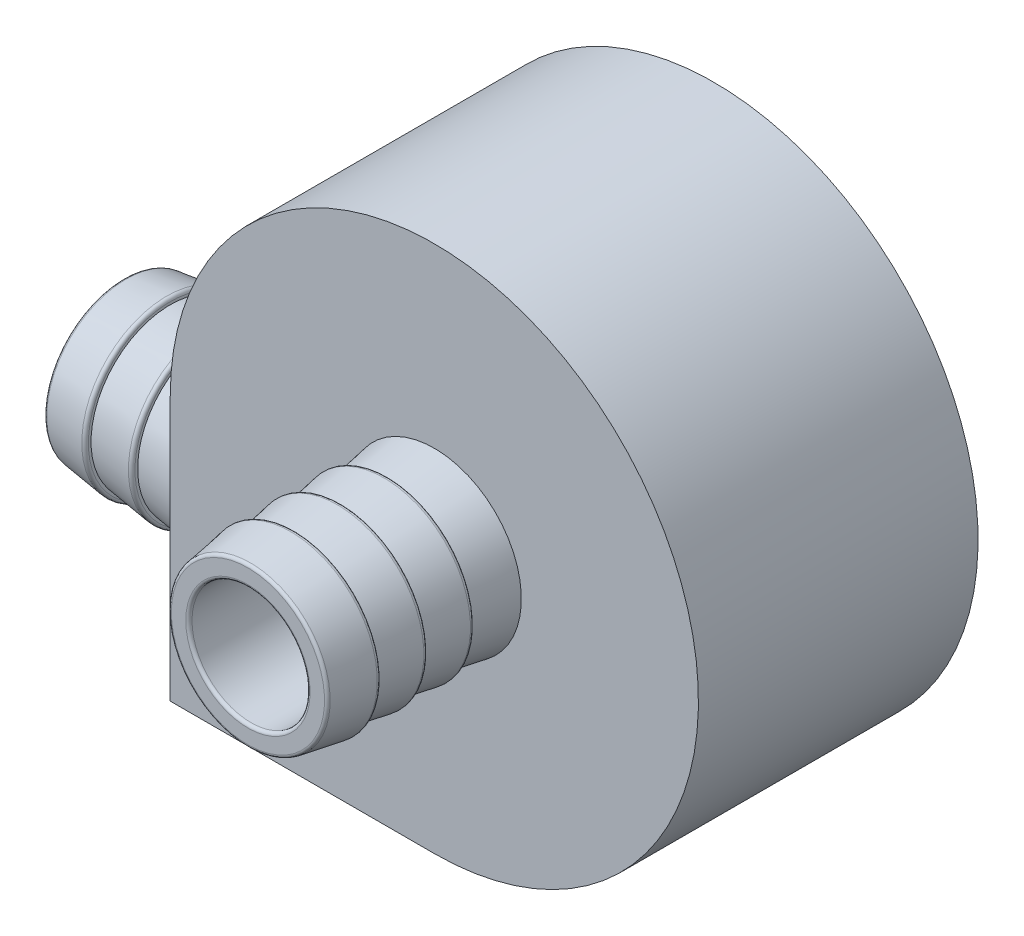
SolidWorks part; units mm, degrees
ref_plane "Front Plane" through (0, 0, 0) normal (0, 0, 1) x (1, 0, 0)
ref_plane "Top Plane" through (0, 0, 0) normal (0, 1, 0) x (1, 0, 0)
ref_plane "Right Plane" through (0, 0, 0) normal (1, 0, 0) x (0, 0, -1)
sketch "Sketch1" plane through (0, 0, 0) normal (0, 0, 1) x (1, 0, 0)
  line L0 (0, -21.59) -> (-21.59, -21.59)
  line L1 (-21.59, 0) -> (-21.59, -21.59)
  arc A0 (0, -21.59) -> (-21.59, 0) centre (0, 0) ccw
  dimension "D1" = 43.18
extrude "Boss-Extrude1" add sketch "Sketch1" along normal blind 22.86
sketch "Sketch3" plane through (0, 0, 0) normal (0, 1, 0) x (1, 0, 0)
  line L0 (0, -22.86) -> (0, -46.7539) construction
  line L1 (-21.59, -22.86) -> (21.59, -22.86) construction
  line L3 (4.826, -22.86) -> (7.112, -22.86)
  line L4 (4.826, -22.86) -> (4.826, -37.846)
  line L5 (5.08, -38.1) -> (6.2618, -38.1)
  line L6 (7.112, -22.86) -> (7.112, -26.67) construction
  line L7 (6.5124, -37.8878) -> (7.0627, -34.5858)
  line L8 (6.477, -38.1) -> (6.477, -20.6499) construction
  line L9 (6.8122, -34.29) -> (6.477, -34.29)
  line L10 (6.477, -34.29) -> (7.0627, -30.7758)
  line L11 (6.8122, -30.48) -> (6.477, -30.48)
  line L12 (6.477, -30.48) -> (7.0627, -26.9658)
  line L13 (6.8122, -26.67) -> (6.477, -26.67)
  line L14 (6.477, -26.67) -> (7.112, -22.86)
  line L15 (7.112, -30.48) -> (7.112, -26.67) construction
  arc A0 (4.826, -37.846) -> (5.08, -38.1) centre (5.08, -37.846) ccw
  arc A1 (6.2618, -38.1) -> (6.5124, -37.8878) centre (6.2618, -37.846) ccw
  arc A2 (6.8122, -26.67) -> (7.0627, -26.9658) centre (6.8122, -26.924) cw
  arc A3 (6.8122, -30.48) -> (7.0627, -30.7758) centre (6.8122, -30.734) cw
  arc A4 (6.8122, -34.29) -> (7.0627, -34.5858) centre (6.8122, -34.544) cw
  point P30 (7.112, -34.29)
  dimension "D9" = 0.254
  dimension "D1" = 9.652
  dimension "D2" = 3.81
  dimension "D3" = 15.24
  dimension "D4" = 12.954
  dimension "D5" = 3.81
  dimension "D6" = 3.81
  dimension "D7" = 3.81
  dimension "D8" = 14.224
revolve "Revolve1" add sketch "Sketch3" angle 360 about L0
sketch "Sketch4" plane through (0, 0, 22.86) normal (0, 0, 1) x (1, 0, 0)
  circle A1 centre (0, 0) radius 4.826
  circle A2 centre (0, 0) radius 4.826
  dimension "D1" = 0
extrude "Cut-Extrude1" cut sketch "Sketch4" against normal through all
sketch "Sketch7" plane through (0, 0, 0) normal (0, 0, -1) x (-1, 0, 0)
  circle A0 centre (0, 0) radius 17.1565
extrude "Cut-Extrude2" cut sketch "Sketch7" against normal blind 20.32
ref_plane "Plane1" through (0, -11.43, 0) normal (0, -1, 0) x (1, 0, 0)
sketch "Sketch8" plane through (0, -11.43, 0) normal (0, -1, 0) x (1, 0, 0)
  line L0 (-21.59, 11.43) -> (-48.4546, 11.43) construction
  line L1 (-36.83, 4.953) -> (-21.59, 4.953) construction
  line L2 (-21.59, 6.477) -> (-36.576, 6.477)
  line L3 (-21.59, 6.477) -> (-21.59, 4.445)
  line L4 (-33.02, 4.445) -> (-29.21, 4.445) construction
  line L5 (-36.83, 6.223) -> (-36.83, 5.1754)
  line L6 (-36.6096, 4.9236) -> (-33.3076, 4.4833)
  line L7 (-33.02, 4.7351) -> (-33.02, 4.953)
  line L8 (-33.02, 4.953) -> (-29.4976, 4.4833)
  line L9 (-29.21, 4.7351) -> (-29.21, 4.953)
  line L10 (-29.21, 4.953) -> (-25.6876, 4.4833)
  line L11 (-25.4, 4.7351) -> (-25.4, 4.953)
  line L12 (-25.4, 4.953) -> (-21.59, 4.445)
  line L13 (-29.21, 4.445) -> (-25.4, 4.445) construction
  line L14 (-25.4, 4.445) -> (-21.59, 4.445) construction
  line L15 (-21.59, 22.86) -> (-21.59, 0) construction
  line L16 (-21.59, 11.43) -> (-12.489, 11.43) construction
  arc A0 (-25.4, 4.7351) -> (-25.6876, 4.4833) centre (-25.654, 4.7351) cw
  arc A1 (-29.21, 4.7351) -> (-29.4976, 4.4833) centre (-29.464, 4.7351) cw
  arc A2 (-33.02, 4.7351) -> (-33.3076, 4.4833) centre (-33.274, 4.7351) cw
  arc A3 (-36.6096, 4.9236) -> (-36.83, 5.1754) centre (-36.576, 5.1754) cw
  arc A4 (-36.83, 6.223) -> (-36.576, 6.477) centre (-36.576, 6.223) cw
  dimension "D8" = 0.254
  dimension "D1" = 6.477
  dimension "D2" = 3.81
  dimension "D3" = 3.81
  dimension "D4" = 6.985
  dimension "D5" = 9.906
  dimension "D6" = 15.24
  dimension "D7" = 3.81
revolve "Revolve3" add sketch "Sketch8" angle 360 about L0
sketch "Sketch9" plane through (-21.59, 0, 0) normal (-1, 0, 0) x (0, 0, 1)
  circle A1 centre (11.43, -11.43) radius 4.953
  circle A2 centre (11.43, -11.43) radius 4.953
  dimension "D1" = 0
extrude "Cut-Extrude3" cut sketch "Sketch9" against normal blind 12.7
